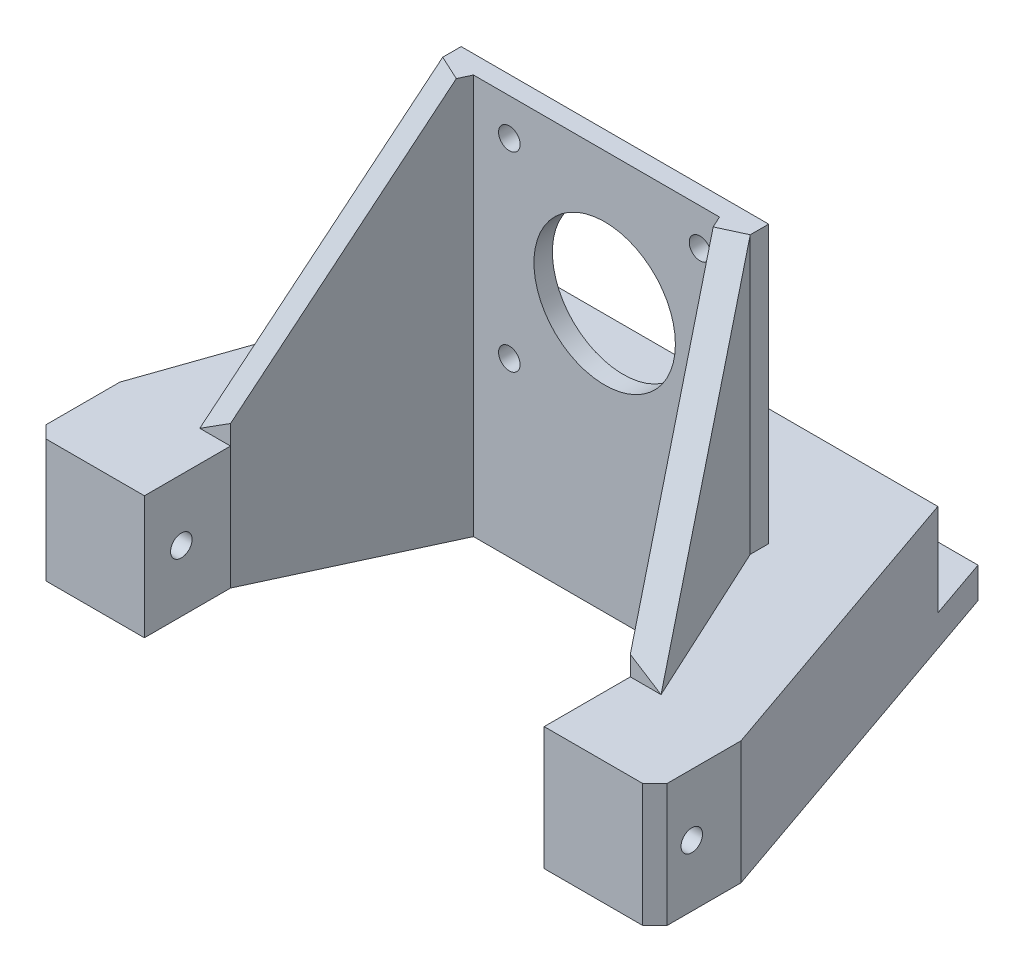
SolidWorks part; units mm, degrees
ref_plane "Спереди" through (0, 0, 0) normal (0, 0, 1) x (1, 0, 0)
ref_plane "Сверху" through (0, 0, 0) normal (0, 1, 0) x (1, 0, 0)
ref_plane "Справа" through (0, 0, 0) normal (1, 0, 0) x (0, 0, -1)
sketch "Эскиз1" plane through (0, 0, 0) normal (0, 1, 0) x (1, 0, 0)
  line L0 (0, 0) -> (0, 22) construction
  line L1 (-7.3469, 0) -> (7.3469, 0) construction
  line L2 (-33.5, 22) -> (33.5, 22)
  line L3 (33.5, 22) -> (50.5, -27)
  line L4 (50.5, -27) -> (32.5, -27)
  line L5 (32.5, -27) -> (20, 0)
  line L6 (20, 0) -> (0, 0)
  line L7 (20, 0) -> (33.5, 22) construction
  line L8 (-20, 0) -> (-33.5, 22) construction
  line L9 (-20, 0) -> (0, 0)
  line L10 (-32.5, -27) -> (-20, 0)
  line L11 (-50.5, -27) -> (-32.5, -27)
  line L12 (-33.5, 22) -> (-50.5, -27)
  line L13 (20, 0) -> (20, -41.7258) construction
  circle A0 centre (25, 10) radius 8.05
  circle A1 centre (-25, 10) radius 8.05
  point P12 (0, 0)
  point P20 (32.5, -27)
  point P21 (0, 0)
  dimension "D1" = 16.1
  dimension "D5" = 50
  dimension "D2" = 22
  dimension "D3" = 67
  dimension "D4" = 101
  dimension "D6" = 18
  dimension "D7" = 10
  dimension "D8" = 27
  dimension "D9" = 20
extrude "Бобышка-Вытянуть1" add sketch "Эскиз1" along normal blind 20 contours L2 L12 L11 L10 L9 L6 L5 L4 L3 A0 A1
sketch "Эскиз3" plane through (0, 20, 0) normal (0, 1, 0) x (1, 0, 0)
  line L1 (25, 0) -> (-25, 0)
  line L2 (25, 0) -> (25, 3)
  line L3 (25, 3) -> (-25, 3)
  line L4 (-25, 0) -> (-25, 3)
  line L6 (-20, 0) -> (20, 0) construction
  line L8 (0, 0) -> (0, 25.9758) construction
  dimension "D1" = 3
  dimension "D2" = 50
extrude "Бобышка-Вытянуть3" add sketch "Эскиз3" along normal blind 45
sketch "Эскиз7" plane through (0, 20, 0) normal (0, 1, 0) x (1, 0, 0)
  circle A0 centre (-25, 10) radius 8.05
  circle A1 centre (25, 10) radius 8.05
  circle A2 centre (25, 10) radius 8.05 construction
  circle A3 centre (-25, 10) radius 8.05 construction
extrude "Бобышка-Вытянуть6" add sketch "Эскиз7" against normal blind 1
sketch "Эскиз9" plane through (0, 0, 0) normal (0, 0, 1) x (1, 0, 0)
  circle A0 centre (1.3309, 43.5) radius 11 construction
  circle A1 centre (16.8309, 28) radius 2 construction
  circle A2 centre (16.8309, 59) radius 2 construction
  circle A3 centre (-14.1691, 59) radius 2 construction
  circle A4 centre (-14.1691, 28) radius 2 construction
  circle A5 centre (1.3309, 43.5) radius 11 construction
  circle A6 centre (16.8309, 28) radius 2 construction
  circle A7 centre (16.8309, 59) radius 2 construction
  circle A8 centre (-14.1691, 59) radius 2 construction
  circle A9 centre (-14.1691, 28) radius 2 construction
  circle A10 centre (-14.1691, 59) radius 1.75
  circle A11 centre (16.8309, 59) radius 1.75
  circle A12 centre (16.8309, 28) radius 1.75
  circle A13 centre (-14.1691, 28) radius 1.75
  circle A14 centre (1.3309, 43.5) radius 11.5
  dimension "D1" = 23
  dimension "D2" = 3.5
extrude "Вырез-Вытянуть1" cut sketch "Эскиз9" against normal blind 10
sketch "Эскиз13" plane through (0, 20, 0) normal (0, 1, 0) x (1, 0, 0)
  line L0 (25, 0) -> (37.5, -27)
  line L1 (37.5, -27) -> (32.5, -27)
  line L2 (32.5, -27) -> (20, 0)
  line L3 (20, 0) -> (25, 0) construction
  line L4 (20, 0) -> (25, 0)
  line L6 (32.5, -27) -> (20, 0) construction
  line L7 (0, 0) -> (0, -25.0641) construction
  line L8 (-20, 0) -> (-25, 0)
  line L9 (-32.5, -27) -> (-20, 0)
  line L10 (-37.5, -27) -> (-32.5, -27)
  line L11 (-25, 0) -> (-37.5, -27)
  line L12 (50.5, -27) -> (32.5, -27) construction
extrude "Бобышка-Вытянуть8" add sketch "Эскиз13" along normal blind 45
sketch "Эскиз14" plane through (20.5874, 0, -9.5312) normal (0.9075, 0, -0.4201) x (-0.4201, 0, -0.9075)
  line L0 (-10.5031, 65) -> (-40.2562, 20)
  line L1 (-40.2562, 20) -> (-40.2562, 65)
  line L2 (-40.2562, 65) -> (-10.5031, 65)
extrude "Вырез-Вытянуть4" cut sketch "Эскиз14" against normal blind 45
sketch "Эскиз15" plane through (-20.5874, 0, -9.5312) normal (-0.9075, 0, -0.4201) x (-0.4201, 0, 0.9075)
  line L0 (10.5031, 65) -> (40.2562, 20)
  line L1 (40.2562, 20) -> (40.2562, 65)
  line L2 (40.2562, 65) -> (10.5031, 65)
extrude "Вырез-Вытянуть5" cut sketch "Эскиз15" against normal blind 45
sketch "Эскиз18" plane through (0, 0, 27) normal (0, 0, 1) x (1, 0, 0)
  line L0 (32.5, 23.1771) -> (32.5, 0) construction
  line L1 (-50.5, 20) -> (-32.5, 20)
  line L2 (-50.5, 20) -> (-50.5, 0)
  line L3 (-50.5, 0) -> (-32.5, 0)
  line L4 (-32.5, 20) -> (-32.5, 0)
  line L5 (50.5, 0) -> (32.5, 0)
  line L6 (50.5, 0) -> (50.5, 20)
  line L7 (50.5, 20) -> (32.5, 20)
  line L8 (32.5, 0) -> (32.5, 20)
  line L9 (50.5, 20) -> (37.5, 20) construction
extrude "Бобышка-Вытянуть9" add sketch "Эскиз18" along normal blind 14
sketch "Эскиз19" plane through (-50.5, 0, 0) normal (-1, 0, 0) x (0, 0, 1)
  line L0 (41, 10) -> (27, 10) construction
  line L1 (41, 20) -> (41, 0) construction
  line L2 (27, 20) -> (27, 0) construction
  circle A0 centre (35, 10) radius 1.75
  dimension "D1" = 6
  dimension "D2" = 3.5
extrude "Вырез-Вытянуть8" cut sketch "Эскиз19" against normal blind 134
sketch "Эскиз20" plane through (0, 0, 0) normal (0, -1, 0) x (1, 0, 0)
  line L0 (-33.5, -22) -> (-30.0306, -32)
  line L1 (-30.0306, -32) -> (30.0306, -32)
  line L2 (30.0306, -32) -> (33.5, -22)
  line L3 (33.5, -22) -> (-33.5, -22)
  line L4 (-33.5, -22) -> (-50.5, 27) construction
  line L5 (33.5, -22) -> (50.5, 27) construction
  dimension "D1" = 10
extrude "Бобышка-Вытянуть10" add sketch "Эскиз20" against normal blind 5
sketch "Эскиз21" plane through (0, 0, 0) normal (0, -1, 0) x (1, 0, 0)
  circle A0 centre (-16.6, -26.5) radius 1.6 construction
  circle A1 centre (10.9, -26.5) radius 1.6 construction
  circle A2 centre (-16.6, -26.5) radius 1.6 construction
  circle A3 centre (10.9, -26.5) radius 1.6 construction
  circle A4 centre (-16.6, -26.5) radius 1.4
  circle A5 centre (10.9, -26.5) radius 1.4
  dimension "D1" = 2.8
extrude "Вырез-Вытянуть9" cut sketch "Эскиз21" against normal blind 5
sketch "Эскиз22" plane through (0, 0, 0) normal (0, -1, 0) x (1, 0, 0)
  line L0 (-50.5, 39) -> (-48.5, 41)
  line L1 (-50.5, 41) -> (-50.5, 27) construction
  line L2 (-50.5, 41) -> (-32.5, 41) construction
  line L3 (-48.5, 41) -> (-50.5, 41)
  line L4 (-50.5, 41) -> (-50.5, 39)
  line L5 (0, 0) -> (0, 35.6208) construction
  line L6 (50.5, 41) -> (50.5, 39)
  line L7 (48.5, 41) -> (50.5, 41)
  line L8 (50.5, 39) -> (48.5, 41)
  dimension "D1" = 2
extrude "Вырез-Вытянуть10" cut sketch "Эскиз22" against normal up to vertex
